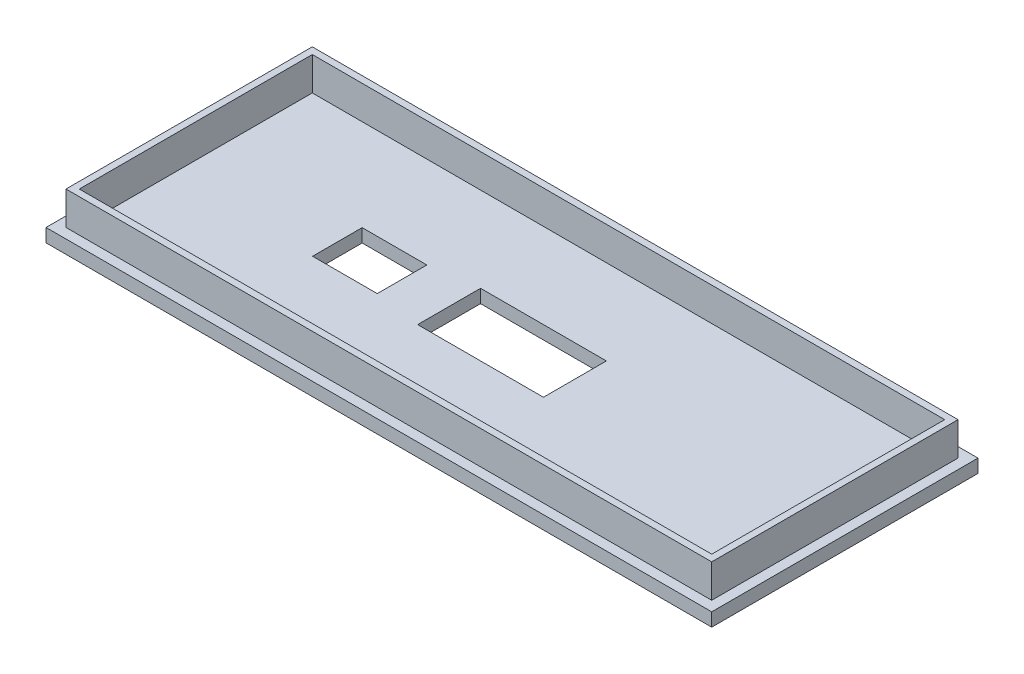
SolidWorks part; units mm, degrees
ref_plane "Front Plane" through (0, 0, 0) normal (0, 0, 1) x (1, 0, 0)
ref_plane "Top Plane" through (0, 0, 0) normal (0, 1, 0) x (1, 0, 0)
ref_plane "Right Plane" through (0, 0, 0) normal (1, 0, 0) x (0, 0, -1)
sketch "Sketch1" plane through (0, 0, 0) normal (0, 1, 0) x (1, 0, 0)
  line L1 (-63.5, 25.4) -> (63.5, 25.4)
  line L2 (-63.5, 25.4) -> (-63.5, -25.4)
  line L3 (-63.5, -25.4) -> (63.5, -25.4)
  line L4 (63.5, 25.4) -> (63.5, -25.4)
  line L5 (-63.5, 25.4) -> (63.5, -25.4) construction
  line L6 (-63.5, -25.4) -> (63.5, 25.4) construction
  point P0 (0, 0)
extrude "Boss-Extrude1" add sketch "Sketch1" along normal blind 2.54
sketch "Sketch2" plane through (0, 2.54, 0) normal (0, 1, 0) x (1, 0, 0)
  line L1 (-61.595, 23.495) -> (61.595, 23.495)
  line L2 (-61.595, 23.495) -> (-61.595, -23.495)
  line L3 (-61.595, -23.495) -> (61.595, -23.495)
  line L4 (61.595, 23.495) -> (61.595, -23.495)
  line L5 (-61.595, 23.495) -> (61.595, -23.495) construction
  line L6 (-61.595, -23.495) -> (61.595, 23.495) construction
  point P0 (0, 0)
extrude "Boss-Extrude2" add sketch "Sketch2" along normal blind 6.35
sketch "Sketch3" plane through (0, 8.89, 0) normal (0, 1, 0) x (1, 0, 0)
  line L1 (-60.325, 22.225) -> (60.325, 22.225)
  line L2 (-60.325, 22.225) -> (-60.325, -22.225)
  line L3 (-60.325, -22.225) -> (60.325, -22.225)
  line L4 (60.325, 22.225) -> (60.325, -22.225)
  line L5 (-60.325, 22.225) -> (60.325, -22.225) construction
  line L6 (-60.325, -22.225) -> (60.325, 22.225) construction
  point P0 (0, 0)
extrude "Cut-Extrude1" cut sketch "Sketch3" against normal blind 6.35
sketch "Sketch4" plane through (0, 2.54, 0) normal (0, 1, 0) x (1, 0, 0)
  line L1 (-12, 6) -> (12, 6)
  line L2 (-12, 6) -> (-12, -6)
  line L3 (-12, -6) -> (12, -6)
  line L4 (12, 6) -> (12, -6)
  line L5 (-12, 6) -> (12, -6) construction
  line L6 (-12, -6) -> (12, 6) construction
  line L7 (-33.3156, 4.73) -> (-20.9765, 4.73)
  line L8 (-33.3156, 4.73) -> (-33.3156, -4.73)
  line L9 (-33.3156, -4.73) -> (-20.9765, -4.73)
  line L10 (-20.9765, 4.73) -> (-20.9765, -4.73)
  line L11 (-33.3156, 4.73) -> (-20.9765, -4.73) construction
  line L12 (-33.3156, -4.73) -> (-20.9765, 4.73) construction
  point P0 (0, 0)
  point P6 (-27.146, 0)
extrude "Cut-Extrude2" cut sketch "Sketch4" against normal blind 10
